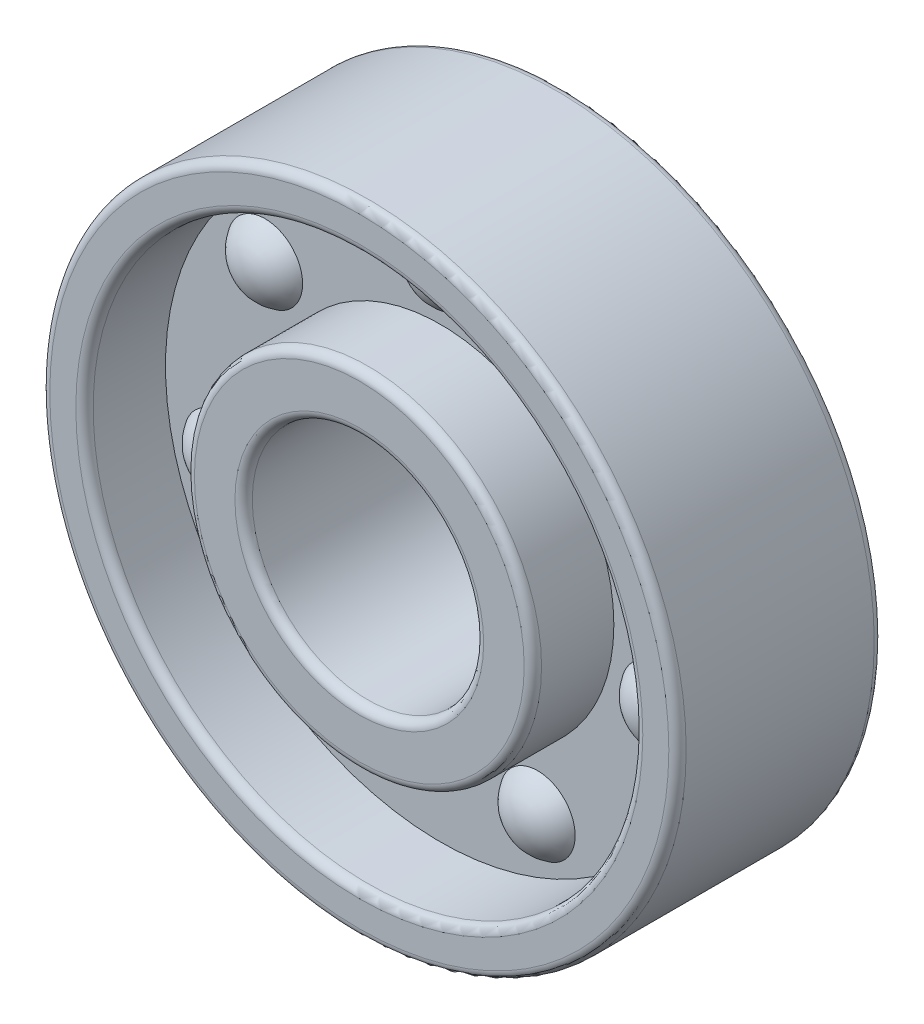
SolidWorks part; units mm, degrees
ref_plane "Plan de face" through (0, 0, 0) normal (0, 0, 1) x (1, 0, 0)
ref_plane "Plan de dessus" through (0, 0, 0) normal (0, 1, 0) x (1, 0, 0)
ref_plane "Plan de droite" through (0, 0, 0) normal (1, 0, 0) x (0, 0, -1)
sketch "Esquisse1" plane through (0, 0, 0) normal (0, 0, 1) x (1, 0, 0)
  circle A0 centre (0, 0) radius 11
  circle A1 centre (0, 0) radius 4
  dimension "D1" = 22
  dimension "D2" = 8
extrude "Boss.-Extru.1" add sketch "Esquisse1" along normal blind 7.1
sketch "Esquisse2" plane through (0, 0, 0) normal (1, 0, 0) x (0, 0, -1)
  line L0 (-3.55, 11) -> (-3.55, -11) construction
  line L1 (0, 11) -> (-7.1, 11) construction
  line L2 (-7.1, 0) -> (0, 0) construction
  line L3 (-7.1, 11) -> (-7.1, -11) construction
  line L4 (-7.1, -11) -> (0, -11) construction
  line L5 (0, -11) -> (0, 11) construction
  line L6 (-2.8, 9.5) -> (2, 9.5)
  line L7 (-2.8, 6) -> (2, 6)
  line L8 (-2.8, 9.5) -> (-2.8, 6)
  line L9 (2, 9.5) -> (2, 6)
  line L10 (-9.1, 9.5) -> (-9.1, 6)
  line L11 (-4.3, 9.5) -> (-4.3, 6)
  line L12 (-4.3, 6) -> (-9.1, 6)
  line L13 (-4.3, 9.5) -> (-9.1, 9.5)
  dimension "D1" = 9.5
  dimension "D2" = 6
  dimension "D3" = 2.8
  dimension "D4" = 2
revolve "Enlèvement de matière-Révolution1" cut sketch "Esquisse2" angle 360 about L2
sketch "Esquisse3" plane through (0, 0, 0) normal (1, 0, 0) x (0, 0, -1)
  line L0 (-3.55, 9.5) -> (-3.55, 6) construction
  line L2 (-4.3, 9.5) -> (-2.8, 9.5) construction
  line L3 (-2.8, 6) -> (-4.3, 6) construction
  line L4 (-2.8, -9.5) -> (-2.8, 9.5) construction
  line L5 (0, 6) -> (-2.8, 6) construction
  line L6 (-4.3, 9.5) -> (-4.3, -9.5) construction
  line L7 (-3.55, 9.25) -> (-3.55, 6.25)
  arc A0 (-3.55, 6.25) -> (-3.55, 9.25) centre (-3.55, 7.75) ccw
  dimension "D1" = 3
revolve "Révolution1" add sketch "Esquisse3" angle 360 about L0
pattern_circular "Répétition circulaire1" count 7 over 360 about axis through (0, 0, 0) along (0, 0, 1) of "Révolution1"
fillet "Congé1" radius 0.3 8 edges at (4, 0, 7.1) (6, 0, 7.1) (9.5, 0, 7.1) (4, 0, 0) (6, 0, 0) (9.5, 0, 0) (11, 0, 7.1) (11, 0, 0)
